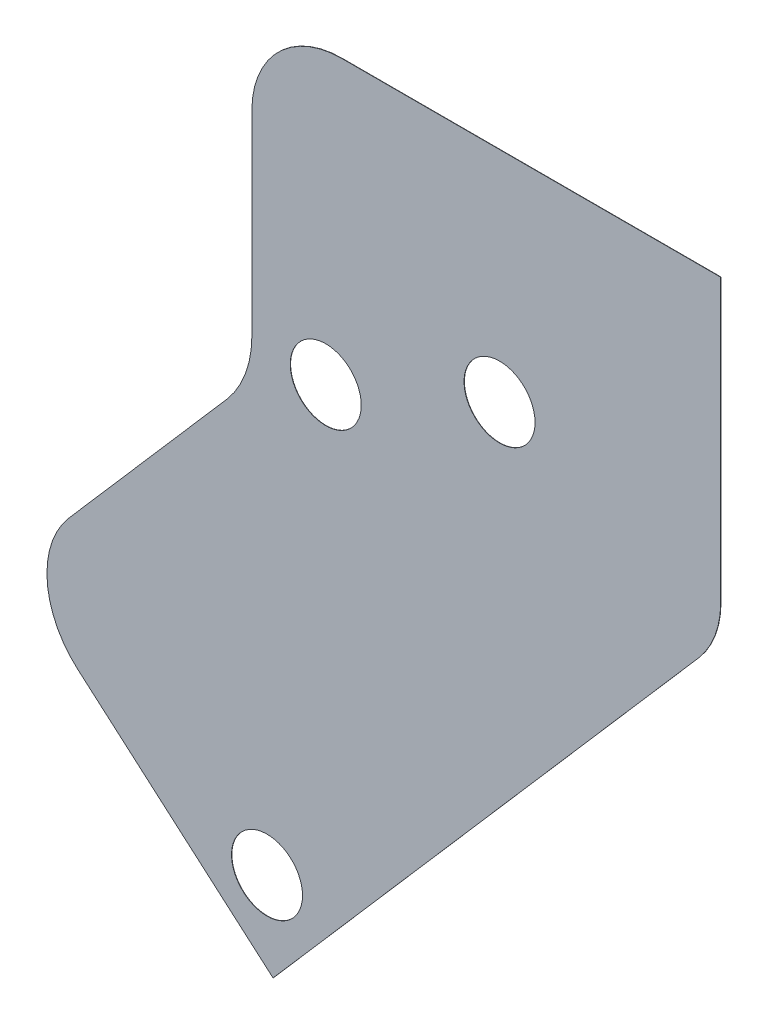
SolidWorks part; units mm, degrees
ref_plane "Front" through (0, 0, 0) normal (0, 0, 1) x (1, 0, 0)
ref_plane "Top" through (0, 0, 0) normal (0, 1, 0) x (1, 0, 0)
ref_plane "Right" through (0, 0, 0) normal (1, 0, 0) x (0, 0, -1)
sketch "Sketch1" plane through (0, 0, 0) normal (0, 0, 1) x (1, 0, 0)
  line L12 (-664.083, -35.9898) -> (-664.083, -13.7079)
  line L13 (-699.4903, -79.4185) -> (-665.8252, -40.6531)
  line L14 (-714.9284, -66.0116) -> (-699.4903, -79.4185)
  line L15 (-703.1581, -41.6115) -> (-715.6349, -55.9786)
  line L16 (-701.167, -20.8199) -> (-701.167, -36.2821)
  line L17 (-664.083, -13.7079) -> (-694.055, -13.7079)
  line L18 (-664.083, -35.9898) -> (-664.083, -13.7079)
  line L19 (-699.4903, -79.4185) -> (-665.8252, -40.6531)
  line L20 (-714.9284, -66.0116) -> (-699.4903, -79.4185)
  line L21 (-703.1581, -41.6115) -> (-715.6349, -55.9786)
  line L22 (-701.167, -20.8199) -> (-701.167, -36.2821)
  line L23 (-664.083, -13.7079) -> (-694.055, -13.7079)
  arc A8 (-665.8252, -40.6531) -> (-664.083, -35.9898) centre (-671.195, -35.9898) ccw
  arc A9 (-715.6349, -55.9786) -> (-714.9284, -66.0116) centre (-710.2651, -60.6418) ccw
  arc A10 (-703.1581, -41.6115) -> (-701.167, -36.2821) centre (-709.295, -36.2821) ccw
  arc A11 (-694.055, -13.7079) -> (-701.167, -20.8199) centre (-694.055, -20.8199) ccw
  arc A12 (-665.8252, -40.6531) -> (-664.083, -35.9898) centre (-671.195, -35.9898) ccw
  arc A13 (-715.6349, -55.9786) -> (-714.9284, -66.0116) centre (-710.2651, -60.6418) ccw
  arc A14 (-703.1581, -41.6115) -> (-701.167, -36.2821) centre (-709.295, -36.2821) ccw
  arc A15 (-694.055, -13.7079) -> (-701.167, -20.8199) centre (-694.055, -20.8199) ccw
  dimension "D1" = 0.508
extrude "Boss-Extrude1" add sketch "Sketch1" along normal blind 0.0254 separate body
hole_wizard "Hole1" positions "Point_Sketch" profile "Profil_Sketch" hole size "Ø0.15" standard "ISO"
sketch "Point_Sketch" plane through (-698.9793, -26.0937, 0.0254) normal (0, 0, -1) x (1, 0, 0)
  point P0 (3.6543, 10.6011)
  point P2 (17.4025, 4.9149)
  point P4 (-0.9904, 46.5166)
sketch "Profil_Sketch" plane through (-695.325, -36.6949, 0.0254) normal (1, 0, 0) x (0, -1, 0)
  line L0 (0, 0) -> (0, 0.0254)
  line L1 (0, 0.0254) -> (2.8067, 0.0254)
  line L2 (2.8067, 0.0254) -> (2.8067, 0)
  line L5 (2.8067, 0) -> (0, 0)
  line L11 (0, -6.35) -> (0, 107.95) construction
  dimension "Diameter" = 5.6134
  dimension "Thru Hole Depth" = 0.0254
other "usin_DL090_10-24x1.75-SHCS<1>"
